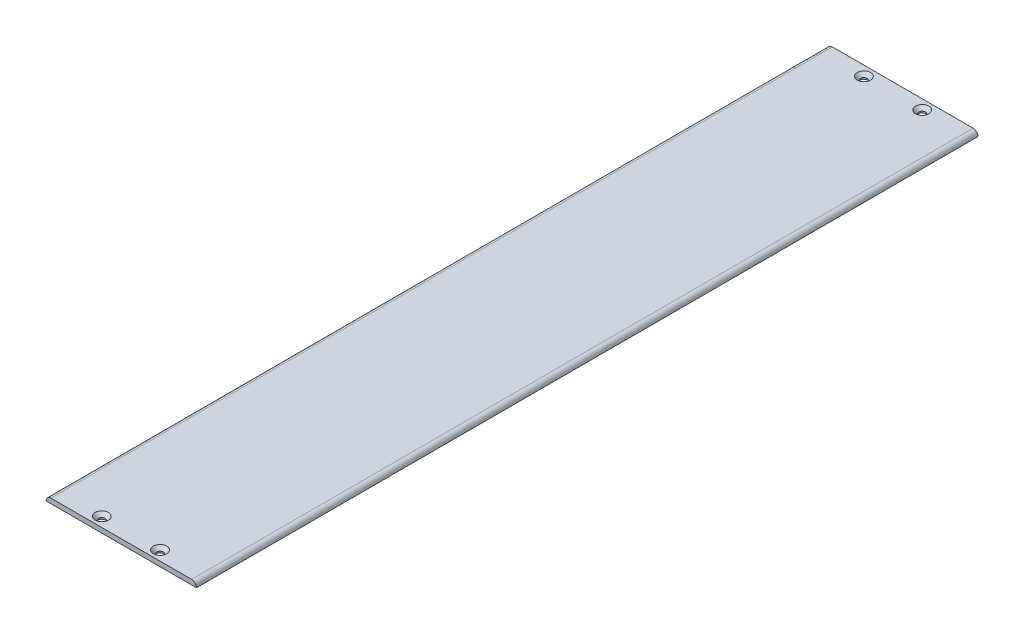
SolidWorks part; units mm, degrees
ref_plane "Front Plane" through (0, 0, 0) normal (0, 0, 1) x (1, 0, 0)
ref_plane "Top Plane" through (0, 0, 0) normal (0, 1, 0) x (1, 0, 0)
ref_plane "Right Plane" through (0, 0, 0) normal (1, 0, 0) x (0, 0, -1)
sketch "Sketch1" plane through (0, 0, 0) normal (0, 0, 1) x (1, 0, 0)
  line L1 (-31, 2) -> (31, 2)
  line L2 (-31, 2) -> (-31, 0)
  line L3 (-31, 0) -> (31, 0)
  line L4 (31, 2) -> (31, 0)
  dimension "D1" = 2
  dimension "D2" = 62
extrude "Extrude1" add sketch "Sketch1" along normal mid plane 322
fillet "Fillet1" radius 2 2 edges at (31, 2, 0) (-31, 2, 0)
sketch "Sketch2" plane through (0, 2, 0) normal (0, 1, 0) x (1, 0, 0)
  line L0 (-31, 161) -> (31, 161) construction
  line L1 (29, 161) -> (-29, 161) construction
  line L2 (29, -161) -> (-29, -161) construction
  point P0 (-12, -157)
  point P1 (12, -157)
  point P2 (12, 157)
  point P3 (-12, 157)
  point P4 (0, 161)
  point P9 (0, -161)
  dimension "D1" = 24
  dimension "D2" = 12
  dimension "D3" = 4
  dimension "D4" = 4
  dimension "D5" = 12
  dimension "D6" = 24
  dimension "D7" = 4
  dimension "D8" = 4
hole_wizard "CSK for M2.5 Flat Head Machine Screw1" positions "3DSketch1" profile "Sketch3" countersink size "M2.5" standard "ANSI Metric"
sketch3d "3DSketch1"
  point P0 (-12, 2, 157)
  point P3 (12, 2, 157)
  point P6 (12, 2, -157)
  point P9 (-12, 2, -157)
sketch "Sketch3" plane through (-12, 2, 157) normal (1, 0, 0) x (0, 0, 1)
  line L0 (0, 0) -> (0, 2)
  line L1 (0, 2) -> (1.35, 2)
  line L2 (1.35, 2) -> (1.35, 1.4)
  line L3 (1.35, 1.4) -> (2.75, 0)
  line L5 (2.75, 0) -> (0, 0)
  line L6 (-1.35, 1.4) -> (-2.75, 0) construction
  line L11 (0, -6.35) -> (0, 107.95) construction
  dimension "Thru Hole Dia." = 2.7
  dimension "Thru Hole Depth" = 2
  dimension "Near C'Sink Dia." = 5.5
  dimension "Near C'Sink Angle" = 90
